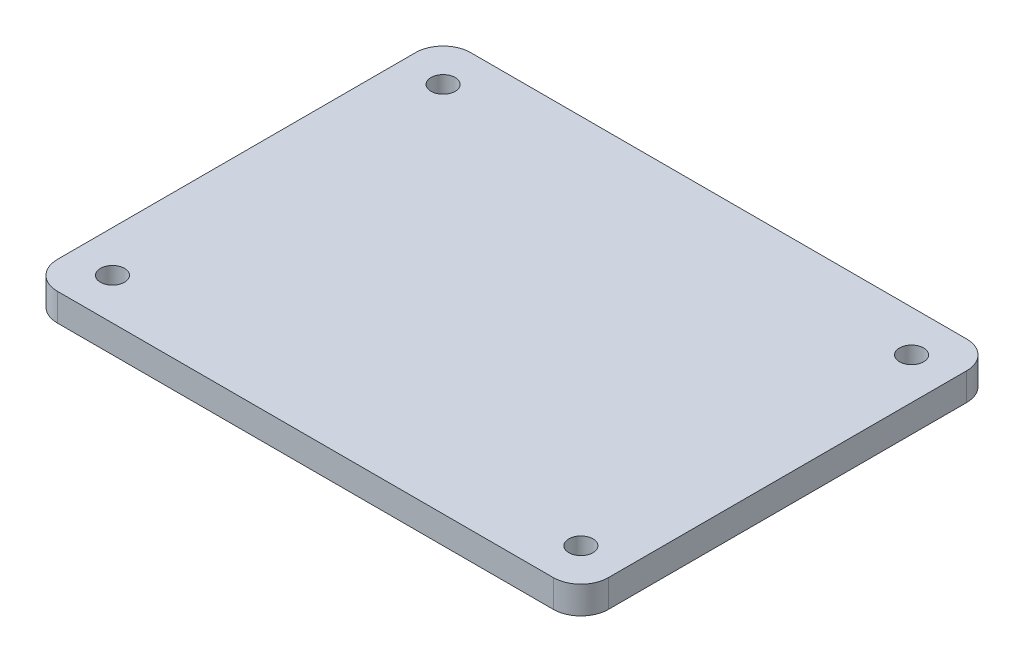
SolidWorks part; units mm, degrees
ref_plane "Ebene vorne" through (0, 0, 0) normal (0, 0, 1) x (1, 0, 0)
ref_plane "Ebene oben" through (0, 0, 0) normal (0, 1, 0) x (1, 0, 0)
ref_plane "Ebene rechts" through (0, 0, 0) normal (1, 0, 0) x (0, 0, -1)
sketch "Skizze1" plane through (0, 0, 0) normal (0, 1, 0) x (1, 0, 0)
  line L0 (0, 30) -> (0, -30) construction
  line L1 (-36, 30) -> (36, 30)
  line L2 (-40, 26) -> (-40, -26)
  line L3 (-36, -30) -> (36, -30)
  line L4 (40, 26) -> (40, -26)
  line L5 (-40, 0) -> (40, 0) construction
  arc A0 (-40, -26) -> (-36, -30) centre (-36, -26) ccw
  arc A1 (36, -30) -> (40, -26) centre (36, -26) ccw
  arc A2 (40, 26) -> (36, 30) centre (36, 26) ccw
  arc A3 (-36, 30) -> (-40, 26) centre (-36, 26) ccw
  circle A4 centre (-34, 24) radius 1.75
  circle A5 centre (34, 24) radius 1.75
  circle A6 centre (34, -24) radius 1.75
  circle A7 centre (-34, -24) radius 1.75
  point P8 (40, -30)
  point P11 (40, 30)
  point P14 (-40, 30)
  dimension "D3" = 4
  dimension "D4" = 3.5
  dimension "D1" = 80
  dimension "D2" = 60
  dimension "D5" = 68
  dimension "D6" = 48
extrude "Aufsatz-Linear austragen1" add sketch "Skizze1" along normal blind 4
